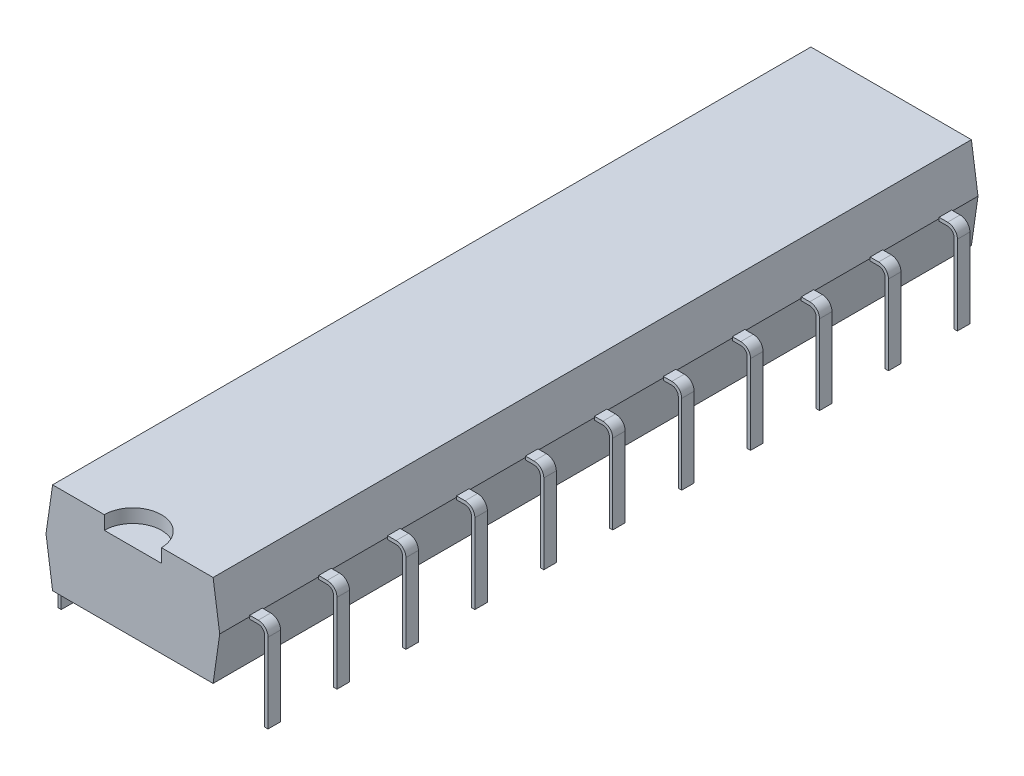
SolidWorks part; units mm, degrees
ref_plane "Plan1" through (0, 0, 0) normal (0, 0, 1) x (1, 0, 0)
ref_plane "Plan2" through (0, 0, 0) normal (0, 1, 0) x (1, 0, 0)
ref_plane "Plan3" through (0, 0, 0) normal (1, 0, 0) x (0, 0, -1)
sketch "Esquisse2" plane through (0, 0, 0) normal (0, 0, 1) x (1, 0, 0)
  line L0 (0, 0) -> (0, 3.0799) construction
  line L1 (2.957, 0) -> (-2.957, 0)
  line L2 (-2.1609, 1.7) -> (1.942, 1.7) construction
  line L3 (2.957, 0) -> (3.2, 1.7)
  line L4 (2.957, 3.3822) -> (-2.957, 3.3822)
  line L5 (2.957, 3.3822) -> (3.2, 1.7)
  line L6 (-2.957, 3.3822) -> (-3.2, 1.7)
  line L7 (-2.957, 0) -> (-3.2, 1.7)
  point P11 (0, 3.3822)
extrude "Base-Extrusion" add sketch "Esquisse2" along normal blind 2.54
sketch "Esquisse3" plane through (3.3752, 0.4876, 0) normal (0.9897, 0.143, 0) x (0, 0, -1)
  line L0 (-2.54, 1.225) -> (0, 1.225) construction
  point P0 (-1.2008, 1.225)
ref_plane "Plan4" through (0, 0, 1.2008) normal (0, 0, 1) x (1, 0, 0)
sketch "Esquisse4" plane through (0, 0, 1.2008) normal (0, 0, 1) x (1, 0, 0)
  line L2 (3.197, 1.679) -> (3.51, 1.679)
  line L3 (2.957, 0) -> (3.2, 1.7) construction
  line L4 (3.81, 1.379) -> (3.81, -1.5503)
  arc A0 (3.81, 1.379) -> (3.51, 1.679) centre (3.51, 1.379) ccw
  dimension "D2" = 0.3
  dimension "D1" = 3.81
extrude "Boss.-Extru.-Mince1" add sketch "Esquisse4" along normal blind 0.23 and the other way blind 0.23 thin
mirror "Symétrie1" about plane through (0, 0, 0) normal (1, 0, 0) of "Boss.-Extru.-Mince1"
pattern_linear "Répétition linéaire1" count 11 spacing 2.54 along (0, 0, -1) of "Symétrie1", "Boss.-Extru.-Mince1", "Base-Extrusion"
sketch "Esquisse5" plane through (0, 3.3822, 0) normal (0, 1, 0) x (-1, 0, 0)
  line L0 (0, 2.54) -> (0.2107, -1.9888) construction
  line L2 (-2.957, 2.54) -> (2.957, 2.54) construction
  line L3 (1.0526, 2.54) -> (0, 2.54)
  line L4 (0, 2.54) -> (-1.0526, 2.54)
  arc A0 (-1.0526, 2.54) -> (1.0526, 2.54) centre (0, 2.54) ccw
extrude "Enlèv. mat.-Extru.1" cut sketch "Esquisse5" against normal blind 0.5
